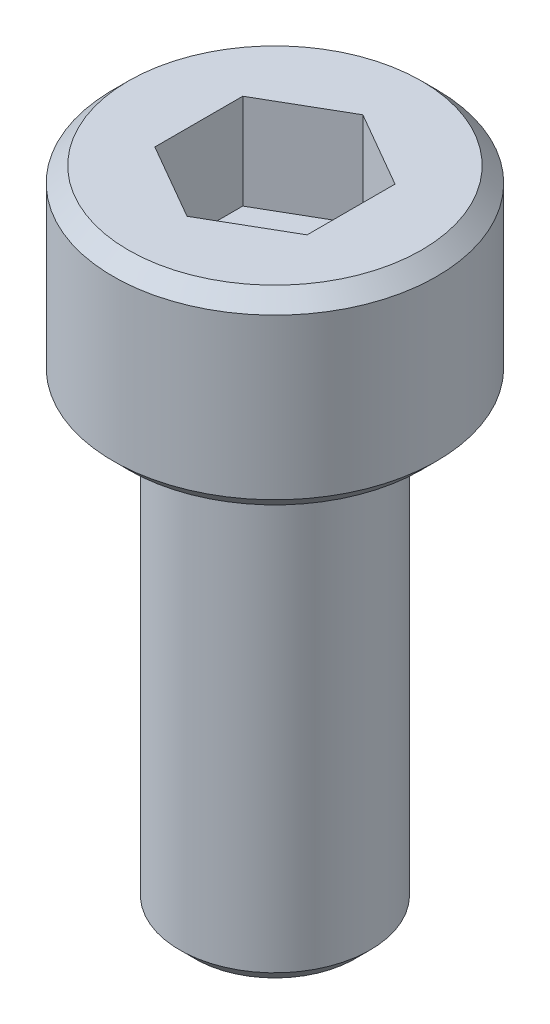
SolidWorks part; units mm, degrees
ref_plane "Face" through (0, 0, 0) normal (0, 0, 1) x (1, 0, 0)
ref_plane "Dessus" through (0, 0, 0) normal (0, 1, 0) x (1, 0, 0)
ref_plane "Droite" through (0, 0, 0) normal (1, 0, 0) x (0, 0, -1)
sketch "Esquisse1" plane through (0, 0, 0) normal (0, 0, 1) x (1, 0, 0)
  line L0 (0, 0) -> (0, 32.1848) construction
  line L1 (0, 0) -> (2.5, 0)
  line L2 (2.5, 0) -> (2.5, 12)
  line L3 (2.5, 12) -> (4.25, 12)
  line L4 (4.25, 12) -> (4.25, 17)
  line L5 (4.25, 17) -> (0, 17)
  line L6 (0, 0) -> (0, 17)
  dimension "D1" = 5
  dimension "D2" = 12
  dimension "D3" = 8.5
  dimension "D4" = 5
revolve "Révolution1" add sketch "Esquisse1" angle 360 about L0
chamfer "Chanfrein1" distance 0.4 angle 45 3 edges at (0, 0, -2.5) (0, 17, -4.25) (0, 12, -4.25)
sketch "Esquisse2" plane through (0, 17, 0) normal (0, 1, 0) x (-1, 0, 0)
  line L1 (-2, 1.1547) -> (-2, -1.1547)
  line L2 (-2, -1.1547) -> (0, -2.3094)
  line L3 (0, -2.3094) -> (2, -1.1547)
  line L4 (2, -1.1547) -> (2, 1.1547)
  line L5 (2, 1.1547) -> (0, 2.3094)
  line L6 (0, 2.3094) -> (-2, 1.1547)
  circle A0 centre (0, 0) radius 2 construction
  dimension "D1" = 4
extrude "Enlèv. mat.-Extru.1" cut sketch "Esquisse2" against normal blind 2.5
